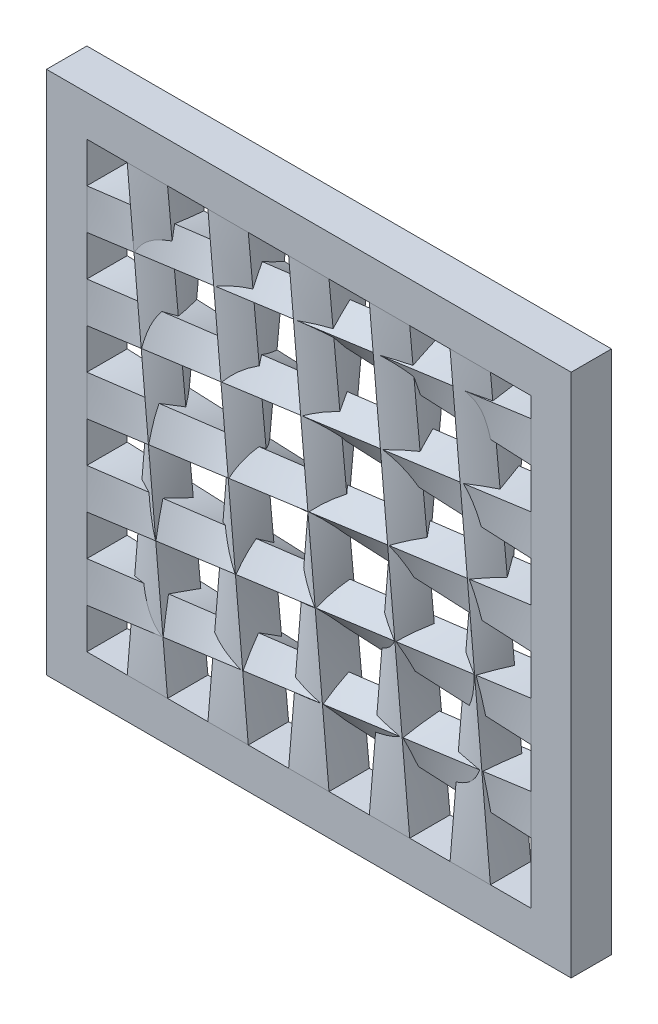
SolidWorks part; units mm, degrees
ref_plane "Piano frontale" through (0, 0, 0) normal (0, 0, 1) x (1, 0, 0)
ref_plane "Piano superiore" through (0, 0, 0) normal (0, 1, 0) x (1, 0, 0)
ref_plane "Piano destro" through (0, 0, 0) normal (1, 0, 0) x (0, 0, -1)
sketch "Sketch1" plane through (0, 0, 0) normal (0, 0, 1) x (1, 0, 0)
  line L0 (-32.5, 32.5) -> (32.5, 32.5)
  line L1 (-27.5, -27.5) -> (27.5, -27.5)
  line L2 (-27.5, -27.5) -> (-27.5, 27.5)
  line L3 (-27.5, 27.5) -> (27.5, 27.5)
  line L4 (27.5, -27.5) -> (27.5, 27.5)
  line L5 (-27.5, -27.5) -> (27.5, 27.5) construction
  line L6 (-27.5, 27.5) -> (27.5, -27.5) construction
  line L7 (32.5, -32.5) -> (32.5, 32.5)
  line L8 (-32.5, -32.5) -> (32.5, -32.5)
  line L9 (-32.5, -32.5) -> (-32.5, 32.5)
  point P0 (0, 0)
  dimension "D1" = 55
  dimension "D2" = 55
  dimension "D3" = 5
extrude "Boss-Extrude1" add sketch "Sketch1" along normal blind 5
sketch "Sketch15" plane through (0, -27.5, 0) normal (0, 1, 0) x (1, 0, 0)
  line L0 (-27.5, -5) -> (27.5, -5) construction
  line L1 (-22.5, -5) -> (-17.5, -5)
  line L2 (-22.5, -5) -> (-22.5, 0)
  line L3 (-22.5, 0) -> (-17.5, 0)
  line L4 (-17.5, -5) -> (-17.5, 0)
  line L5 (-27.5, 0) -> (27.5, 0) construction
  dimension "D1" = 5
  dimension "D2" = 5
sketch "Sketch16" plane through (0, 27.5, 0) normal (0, -1, 0) x (1, 0, 0)
  line L0 (-22.5, 0) -> (-17.5, 0)
  line L1 (-22.5, 0) -> (-22.5, 5)
  line L2 (-22.5, 5) -> (-17.5, 5)
  line L3 (-17.5, 0) -> (-17.5, 5)
  line L4 (27.5, 5) -> (-27.5, 5) construction
  line L5 (-27.5, 5) -> (-27.5, 0) construction
  dimension "D1" = 0
  dimension "D2" = 5
  dimension "D3" = 5
loft "Loft14" add profiles "Sketch16", "Sketch15"
sketch "Sketch17" plane through (-27.5, 0, 0) normal (1, 0, 0) x (0, 0, -1)
  line L0 (-5, 27.5) -> (-5, -27.5) construction
  line L1 (-5, -22.5) -> (0, -22.5)
  line L2 (-5, -22.5) -> (-5, -17.5)
  line L3 (-5, -17.5) -> (0, -17.5)
  line L4 (0, -22.5) -> (0, -17.5)
  line L5 (0, 27.5) -> (0, -27.5) construction
  line L6 (-5, -27.5) -> (0, -27.5) construction
  dimension "D1" = 5
  dimension "D2" = 5
sketch "Sketch18" plane through (27.5, 0, 0) normal (-1, 0, 0) x (0, 0, 1)
  line L1 (-0.1169, -20.0712) -> (4.8831, -20.0712)
  line L2 (-0.1169, -20.0712) -> (-0.1169, -15.0712)
  line L3 (-0.1169, -15.0712) -> (4.8831, -15.0712)
  line L4 (4.8831, -20.0712) -> (4.8831, -15.0712)
  dimension "D1" = 5
loft "Loft17" add profiles "Sketch17", "Sketch18"
pattern_linear "LPattern6" count 5 spacing 10 along (1, 0, 0) of "Loft14"
pattern_linear "LPattern7" count 5 spacing 10 along (0, 1, 0) of "Loft17"
